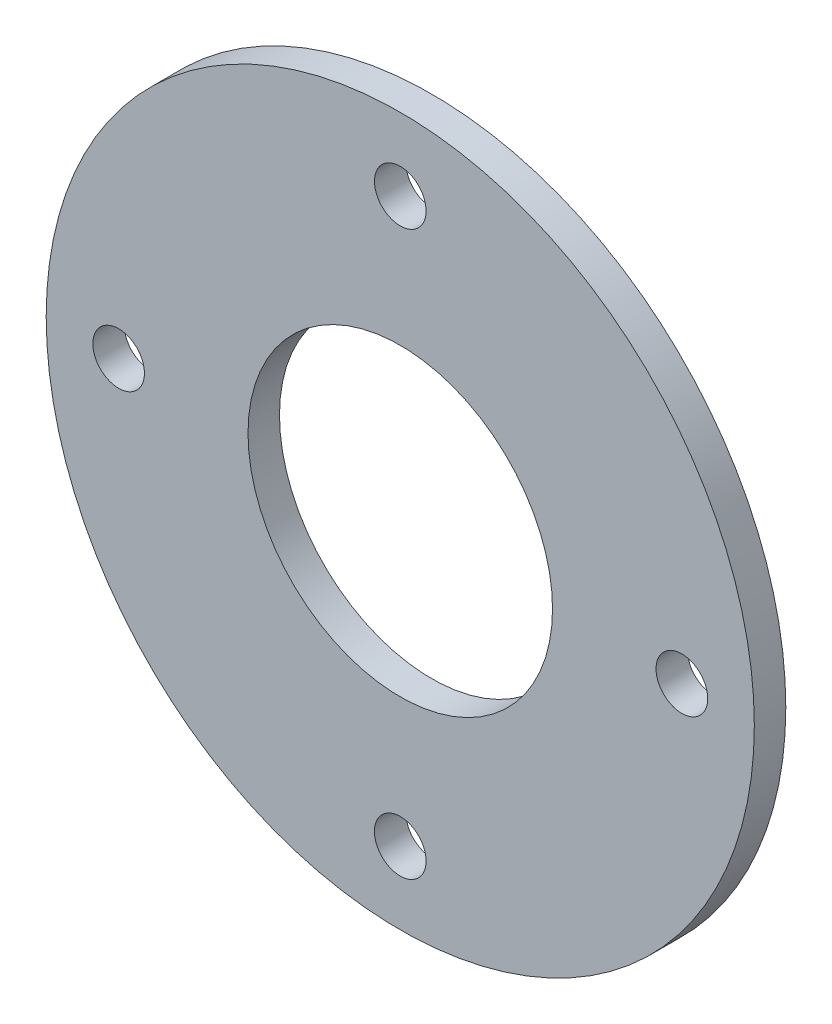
SolidWorks part; units mm, degrees
ref_plane "Front Plane" through (0, 0, 0) normal (0, 0, 1) x (1, 0, 0)
ref_plane "Top Plane" through (0, 0, 0) normal (0, 1, 0) x (1, 0, 0)
ref_plane "Right Plane" through (0, 0, 0) normal (1, 0, 0) x (0, 0, -1)
sketch "Sketch1" plane through (0, 0, 0) normal (0, 0, 1) x (1, 0, 0)
  circle A4 centre (0, 0) radius 114.3 construction
  circle A5 centre (0, 0) radius 49.15 construction
  circle A10 centre (0, 0) radius 114.3
  circle A11 centre (0, 0) radius 49.15
extrude "Extrude1" add sketch "Sketch1" along normal blind 10.16
hole_wizard "5/8 Clearance Hole1" positions "Sketch2" profile "Sketch3" hole size "5/8"
sketch "Sketch2" plane through (-61.2299, -86.9453, 0) normal (0, 0, -1) x (-1, 0, 0)
  line L0 (-61.2299, 86.9453) -> (160.2598, 86.9453) construction
  line L1 (-61.2299, 86.9453) -> (-61.2299, 296.6144) construction
  line L2 (-61.2299, 86.9453) -> (-291.9631, 86.9453) construction
  line L3 (-61.2299, 86.9453) -> (-61.2299, -121.1078) construction
  circle A0 centre (-61.2299, 86.9453) radius 90.9114 construction
  point P0 (-61.2299, 177.798)
  point P1 (29.6815, 86.9453)
  point P2 (-61.2299, -3.9661)
  point P3 (-152.1413, 86.9453)
sketch "Sketch3" plane through (0, 90.8528, 0) normal (1, 0, 0) x (0, 1, 0)
  line L0 (0, 0) -> (0, 10.16)
  line L1 (0, 10.16) -> (8.3337, 10.16)
  line L2 (8.3337, 10.16) -> (8.3337, 0)
  line L3 (8.3337, 0) -> (0, 0)
  line L4 (0, 110) -> (0, -10) construction
  dimension "Diameter" = 16.6675
  dimension "Depth" = 10.16
